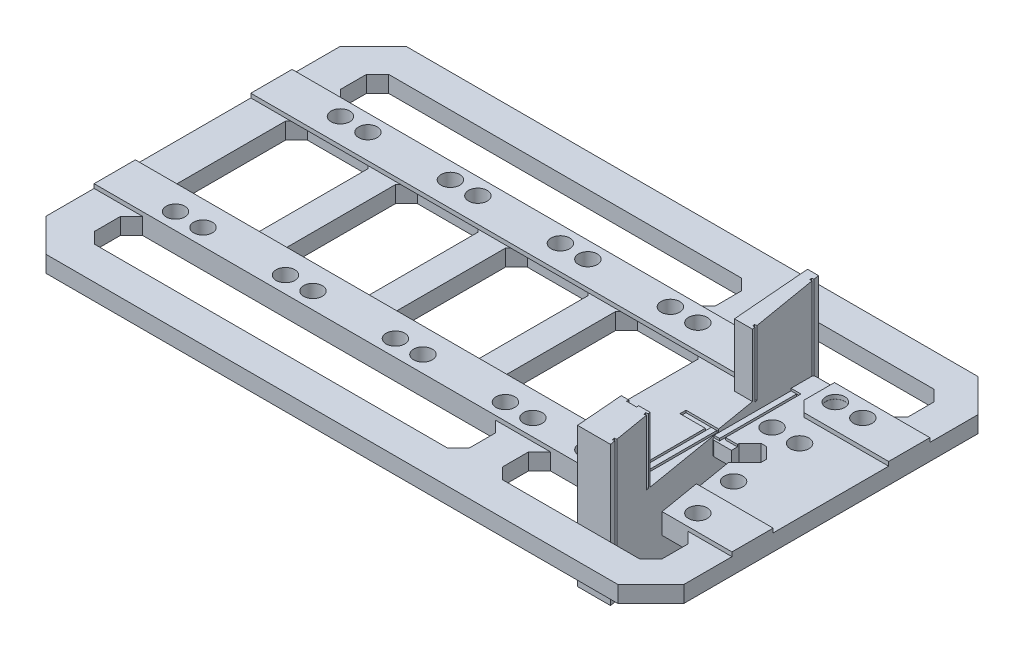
SolidWorks part; units mm, degrees
ref_plane "Front Plane" through (0, 0, 0) normal (0, 0, 1) x (1, 0, 0)
ref_plane "Top Plane" through (0, 0, 0) normal (0, 1, 0) x (1, 0, 0)
ref_plane "Right Plane" through (0, 0, 0) normal (1, 0, 0) x (0, 0, -1)
sketch "Sketch1" plane through (0, 0, 0) normal (0, 1, 0) x (1, 0, 0)
  line L0 (57.5, 0) -> (21.0339, 0) construction
  line L1 (57, -32.75) -> (-47, -32.75)
  line L2 (-53, -26.75) -> (-53, 26.75)
  line L3 (57, 32.75) -> (-47, 32.75)
  line L4 (-53, 26.75) -> (-47, 32.75)
  line L5 (-47, -32.75) -> (-53, -26.75)
  line L6 (63, -26.75) -> (57, -32.75)
  line L7 (63, 26.75) -> (57, 32.75)
  line L8 (13.8, 10) -> (13.8, -10)
  line L9 (-44.2, 18) -> (-46.2, 20)
  line L10 (-46.2, 24.75) -> (-44.2, 26.75)
  line L11 (42.25, 18) -> (55, 18)
  line L12 (22, -20) -> (22, -24.75)
  line L13 (22, 14) -> (22, 26.75) construction
  line L14 (30, 18) -> (34.383, 18)
  line L15 (-6.2, 10) -> (-6.2, -10)
  line L16 (57, 20) -> (57, 24.75)
  line L17 (22, 20) -> (20, 18)
  line L18 (36.2223, 19.9935) -> (36, 22.75)
  line L19 (39.6688, -22.75) -> (39.4465, -19.9935)
  line L20 (42.25, -0.5) -> (42.25, 9.5)
  line L21 (22, 20) -> (22, 24.75)
  line L22 (-46.2, 20) -> (-46.2, 24.75)
  line L23 (20, 18) -> (-44.2, 18)
  line L24 (28, 20) -> (28, 24.75)
  line L25 (63, -26.75) -> (63, 26.75)
  line L26 (-46.2, -20) -> (-46.2, -24.75)
  line L27 (55, 18) -> (57, 20)
  line L28 (28, -20) -> (28, -24.75)
  line L29 (28, 14) -> (28, 26.75) construction
  line L30 (28, -14) -> (28, -26.75) construction
  line L31 (22, 24.75) -> (20, 26.75)
  line L32 (30, -18) -> (37.2858, -18)
  line L33 (30, -26.75) -> (55, -26.75)
  line L34 (20, -18) -> (-44.2, -18)
  line L35 (45.6685, -22.75) -> (39.6688, -22.75)
  line L36 (57, 24.75) -> (55, 26.75)
  line L37 (50.2967, -18) -> (47.8453, -3.4547)
  line L38 (45.6685, -22.75) -> (38, 22.75)
  line L39 (41.85, 9.9) -> (41.85, 17.6)
  line L40 (57, -24.75) -> (55, -26.75)
  line L41 (20, 26.75) -> (-44.2, 26.75)
  line L42 (28, 20) -> (30, 18)
  line L43 (22, -14) -> (22, -26.75) construction
  line L44 (34.383, 18) -> (36.2223, 19.9935)
  line L45 (45.8, -0.9) -> (42.65, -0.9)
  line L46 (30, -18) -> (28, -20)
  line L47 (28, 24.75) -> (30, 26.75)
  line L48 (39.4465, -19.9935) -> (37.2858, -18)
  line L49 (28, -24.75) -> (30, -26.75)
  line L50 (30, 26.75) -> (55, 26.75)
  line L51 (22, -24.75) -> (20, -26.75)
  line L52 (38, 22.75) -> (36, 22.75)
  line L53 (20, -18) -> (22, -20)
  line L54 (45.8, 0.5) -> (47.8, 2.5)
  line L55 (41.85, -0.5) -> (41.85, 13.5) construction
  line L56 (50.8, -0.5) -> (47.8453, -3.4547)
  line L57 (48.8, 2.5) -> (50.8, 0.5)
  line L58 (47.8, 2.5) -> (48.8, 2.5)
  line L59 (50.8, 0.5) -> (50.8, -0.5)
  line L60 (-44.2, -26.75) -> (-46.2, -24.75)
  line L61 (-44.2, -18) -> (-46.2, -20)
  line L62 (42.25, -0.5) -> (42.25, 13.5) construction
  line L63 (45.8, -0.9) -> (45.8, 0.5)
  line L64 (6.8, 12) -> (-4.2, 12)
  line L65 (6.8, -12) -> (-4.2, -12)
  line L66 (8.8, 10) -> (8.8, -10)
  line L67 (-44.2, 12) -> (-46.2, 10)
  line L68 (-33.2, 12) -> (-31.2, 10)
  line L69 (-26.2, 10) -> (-26.2, -10)
  line L70 (-44.2, -12) -> (-46.2, -10)
  line L71 (26.8, 12) -> (15.8, 12)
  line L72 (26.8, -12) -> (15.8, -12)
  line L73 (18, -12) -> (-39, -12) construction
  line L74 (-31.2, -10) -> (-33.2, -12)
  line L75 (20, -26.75) -> (-44.2, -26.75)
  line L76 (18, 12) -> (-39, 12) construction
  line L77 (-13.2, 12) -> (-24.2, 12)
  line L78 (-13.2, -12) -> (-24.2, -12)
  line L79 (-11.2, 10) -> (-11.2, -10)
  line L80 (-24.2, -12) -> (-26.2, -10)
  line L81 (-24.2, 12) -> (-26.2, 10)
  line L82 (-46.2, 10) -> (-46.2, -10)
  line L83 (-13.2, 12) -> (-11.2, 10)
  line L84 (55, -18) -> (57, -20)
  line L85 (-11.2, -10) -> (-13.2, -12)
  line L86 (-33.2, 12) -> (-44.2, 12)
  line L87 (-33.2, -12) -> (-44.2, -12)
  line L88 (-31.2, 10) -> (-31.2, -10)
  line L89 (-4.2, -12) -> (-6.2, -10)
  line L90 (-4.2, 12) -> (-6.2, 10)
  line L91 (6.8, 12) -> (8.8, 10)
  line L92 (8.8, -10) -> (6.8, -12)
  line L93 (15.8, -12) -> (13.8, -10)
  line L94 (15.8, 12) -> (13.8, 10)
  line L95 (26.8, 12) -> (28.8, 10)
  line L96 (28.8, -10) -> (26.8, -12)
  line L98 (57, -20) -> (57, -24.75)
  line L99 (55, -18) -> (50.2967, -18)
  line L106 (18, -18) -> (-39, -18) construction
  line L107 (28.8, 10) -> (28.8, -10)
  line L113 (18, 18) -> (-39, 18) construction
  circle A0 centre (51.3, -6) radius 1.7
  circle A1 centre (51.3, 6) radius 1.7
  circle A2 centre (33.8, -15) radius 1.7
  arc A3 (42.65, -0.9) -> (42.25, -0.5) centre (42.65, -0.5) cw
  circle A4 centre (46.3, 6) radius 1.7
  circle A5 centre (23.8, 15) radius 1.7
  circle A6 centre (18.8, 15) radius 1.7
  arc A7 (42.25, 18) -> (41.85, 17.6) centre (42.25, 17.6) ccw
  arc A8 (41.85, 9.9) -> (42.25, 9.5) centre (42.25, 9.9) ccw
  circle A11 centre (3.8, 15) radius 1.7
  circle A12 centre (-1.2, 15) radius 1.7
  circle A15 centre (-16.2, 15) radius 1.7
  circle A16 centre (-21.2, 15) radius 1.7
  circle A17 centre (48.8, 15) radius 1.7
  circle A19 centre (-36.2, 15) radius 1.7
  circle A20 centre (-41.2, 15) radius 1.7
  circle A23 centre (53.8, -15) radius 1.7
  circle A26 centre (-41.2, -15) radius 1.7
  circle A27 centre (-36.2, -15) radius 1.7
  circle A30 centre (-21.2, -15) radius 1.7
  circle A31 centre (53.8, 15) radius 1.7
  circle A32 centre (-16.2, -15) radius 1.7
  circle A35 centre (-1.2, -15) radius 1.7
  circle A36 centre (3.8, -15) radius 1.7
  circle A39 centre (18.8, -15) radius 1.7
  circle A40 centre (23.8, -15) radius 1.7
  circle A78 centre (33.8, 15) radius 1.7
  point P50 (-13.2, -8)
  point P53 (-33.2, -8)
  point P89 (-44.2, 8)
  point P104 (-4.2, -8)
  point P105 (6.8, -8)
  dimension "D3" = 6
  dimension "D12" = 0.4
  dimension "D5" = 6
  dimension "D6" = 6
  dimension "D4" = 6
  dimension "D7" = 4
extrude "Boss-Extrude1" add sketch "Sketch1" along normal blind 3
sketch "Sketch2" plane through (0, 3, 0) normal (0, 1, 0) x (1, 0, 0)
  line L0 (43.65, 0.1843) -> (48.25, 0.1893)
  line L1 (40.75, 0.5) -> (40.75, -13.5)
  line L2 (48.25, -0.9) -> (48.25, 0.1893)
  line L5 (44.225, -0.9) -> (48.25, -0.9)
  line L6 (35.75, 0.9) -> (35.75, -0.2)
  line L7 (41.75, -13.5) -> (41.75, 0.5)
  line L8 (45.8, -0.9) -> (42.65, -0.9) construction
  line L9 (44.225, -0.9) -> (44.225, -14.1)
  line L13 (35.75, 0.5) -> (35.75, -13.5) construction
  line L14 (42.25, 13.5) -> (43.25, 13.5)
  line L15 (43.25, 13.5) -> (43.25, -0.5)
  line L16 (43.25, -0.5) -> (42.25, -0.5)
  line L17 (41.75, 0.5) -> (40.75, 0.5)
  line L18 (41.75, -13.5) -> (40.75, -13.5)
  line L19 (40.35, -14.1) -> (44.225, -14.1)
  line L22 (41.8, 0.9) -> (35.75, 0.9)
  line L25 (40.35, -14.1) -> (40.35, -0.2)
  line L28 (41.8, 0.9) -> (41.8, 13.9)
  line L31 (43.65, 13.9) -> (41.8, 13.9)
  line L33 (43.65, 0.1843) -> (43.65, 13.9)
  line L35 (35.75, -0.2) -> (40.35, -0.2)
  line L38 (42.25, -0.5) -> (42.25, 13.5)
  dimension "D3" = 5
extrude "Cut-Extrude1" cut sketch "Sketch2" against normal blind 0.4
sketch "Sketch5" plane through (0, 0, 0) normal (0, 1, 0) x (1, 0, 0)
  line L1 (45.6685, -22.75) -> (38, 22.75)
  line L2 (58, 0) -> (-77.055, 0) construction
  line L3 (39.6688, -22.75) -> (36, 22.75)
  line L6 (45.6685, -22.75) -> (39.6688, -22.75)
  line L9 (38, 22.75) -> (36, 22.75)
extrude "Boss-Extrude2" add sketch "Sketch5" against normal blind 11
sketch "Sketch7" plane through (0, 3, 0) normal (0, 1, 0) x (1, 0, 0)
  line L0 (38, 22.75) -> (40.4354, 8.3)
  line L1 (45.6685, -22.75) -> (39.6688, -22.75)
  line L2 (39.6688, -22.75) -> (38.9713, -14.1)
  line L3 (36, 22.75) -> (38, 22.75)
  line L4 (40.4354, 8.3) -> (37.1651, 8.3)
  line L6 (38.9713, -14.1) -> (44.2107, -14.1)
  line L7 (37.1651, 8.3) -> (36, 22.75)
  line L8 (44.2107, -14.1) -> (45.6685, -22.75)
extrude "Boss-Extrude3" add sketch "Sketch7" along normal blind 11.4
sketch "Sketch9" plane through (40.6788, 0, -6.856) normal (0.9861, 0, -0.1662) x (-0.1662, 0, -0.9861)
  line L0 (15.1182, 14.4) -> (14.7182, 14.4)
  line L1 (15.1182, 14.4) -> (15.1182, -11)
  line L2 (14.7182, 14.4) -> (14.7182, -11)
  line L3 (15.1182, -11) -> (14.7182, -11)
  line L4 (-28.6235, 14.4) -> (-28.6235, -11)
  line L5 (-29.0235, 14.4) -> (-29.0235, -11)
  line L6 (-28.6235, 14.4) -> (-29.0235, 14.4)
  line L7 (-28.6235, -11) -> (-29.0235, -11)
  line L8 (-21.6487, 2.6) -> (-22.0487, 2.6)
  line L9 (-30.0235, 14.4) -> (-30.0235, -11) construction
  line L10 (-21.6487, 14.8) -> (-22.0487, 14.8)
  line L11 (2.465, 14.7985) -> (2.065, 14.7991)
  line L12 (2.4644, 14.3985) -> (2.4467, 2.6) construction
  line L13 (-22.0487, 14.4) -> (-22.0487, 2.6) construction
  line L14 (2.0467, 2.6) -> (2.4467, 2.6)
  line L21 (16.1182, 14.4) -> (16.1182, -11) construction
  line L23 (-21.6487, 14.8) -> (-21.6487, 2.6)
  line L24 (2.065, 14.7991) -> (2.0467, 2.6)
  line L27 (-21.6487, 14.4) -> (-21.6487, 2.6) construction
  line L32 (-22.0487, 14.8) -> (-22.0487, 2.6)
  line L33 (2.465, 14.7985) -> (2.4467, 2.6)
  line L50 (2.0644, 14.3991) -> (2.0467, 2.6006) construction
  dimension "D3" = 1
  dimension "D4" = 1
  dimension "D1" = 0.4
  dimension "D2" = 0.4
  dimension "D10" = 0.4
  dimension "D11" = 0.4
extrude "Cut-Extrude5" cut sketch "Sketch9" against normal blind 0.4
sketch "Sketch10" plane through (0, 0, 14.1) normal (0, 0, -1) x (-1, 0, 0)
  line L0 (-42.15, 2.6) -> (-42.15, 14.4)
  line L2 (-40.35, 2.6) -> (-40.35, 14.4)
  line L3 (-40.35, 2.6) -> (-42.15, 2.6)
  line L4 (-42.15, 14.4) -> (-40.35, 14.4)
extrude "Cut-Extrude6" cut sketch "Sketch10" against normal blind 0.4
sketch "Sketch11" plane through (0, 3, 0) normal (0, 1, 0) x (1, 0, 0)
  line L0 (45.65, 18) -> (45.65, 12.5)
  line L1 (34.383, 18) -> (36.2223, 19.9935)
  line L2 (-53, 10.5) -> (-53, 18)
  line L3 (-53, 18) -> (34.383, 18)
  line L4 (63, 10.5) -> (63, 18)
  line L5 (-53, 10.5) -> (36.9877, 10.5)
  line L6 (-53, 26.75) -> (-53, -26.75) construction
  line L7 (-53, -18) -> (37.2858, -18)
  line L8 (-53, -18) -> (-53, -10.5)
  line L10 (63, -18) -> (63, -10.5)
  line L12 (36.9877, 10.5) -> (36.2223, 19.9935)
  line L13 (45.65, 18) -> (63, 18)
  line L14 (36, 22.75) -> (37.1651, 8.3) construction
  line L15 (47.65, 10.5) -> (63, 10.5)
  line L16 (49.0327, -10.5) -> (63, -10.5)
  line L17 (50.2967, -18) -> (63, -18)
  line L19 (45.65, 12.5) -> (47.65, 10.5)
  line L20 (-53, -10.5) -> (35.3713, -10.5)
  line L22 (39.4465, -19.9935) -> (38.9713, -14.1)
  line L23 (39.4465, -19.9935) -> (37.2858, -18)
  line L24 (39.4465, -19.9935) -> (37.2858, -18) construction
  line L25 (38.9713, -14.1) -> (35.3713, -10.5)
  line L26 (50.2967, -18) -> (49.0327, -10.5)
  line L27 (50.2967, -18) -> (47.8453, -3.4547) construction
  circle A0 centre (-41.2, 15) radius 1.7
  circle A1 centre (-41.2, -15) radius 1.7
  circle A2 centre (-36.2, 15) radius 1.7
  circle A3 centre (-36.2, -15) radius 1.7
  circle A8 centre (-21.2, 15) radius 1.7
  circle A9 centre (-21.2, -15) radius 1.7
  circle A10 centre (-16.2, 15) radius 1.7
  circle A11 centre (-16.2, -15) radius 1.7
  circle A16 centre (-1.2, 15) radius 1.7
  circle A17 centre (-1.2, -15) radius 1.7
  circle A18 centre (3.8, 15) radius 1.7
  circle A19 centre (3.8, -15) radius 1.7
  circle A24 centre (18.8, 15) radius 1.7
  circle A25 centre (18.8, -15) radius 1.7
  circle A26 centre (23.8, 15) radius 1.7
  circle A27 centre (23.8, -15) radius 1.7
  circle A30 centre (33.8, 15) radius 1.7
  circle A31 centre (33.8, -15) radius 1.7
  circle A32 centre (48.8, 15) radius 1.7113
  circle A38 centre (53.8, 15) radius 1.7
  circle A39 centre (53.8, -15) radius 1.7
  point P41 (45.65, 10.5)
extrude "Boss-Extrude4" add sketch "Sketch11" along normal blind 0.75
